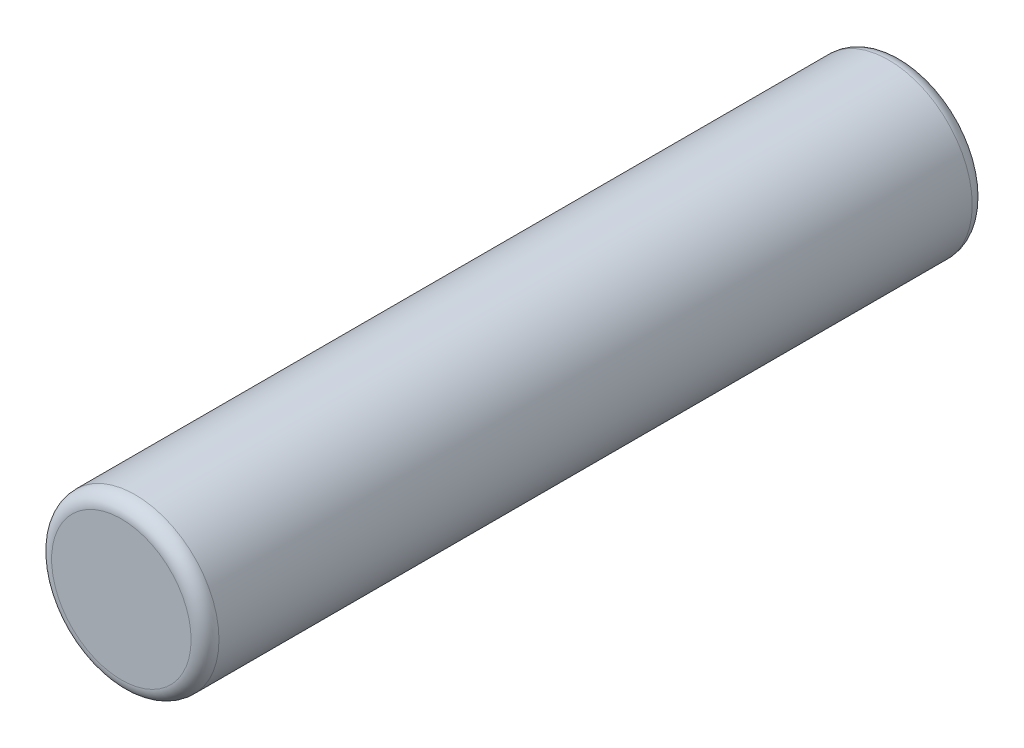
SolidWorks part; units mm, degrees
ref_plane "Спереди" through (0, 0, 0) normal (0, 0, 1) x (1, 0, 0)
ref_plane "Сверху" through (0, 0, 0) normal (0, 1, 0) x (1, 0, 0)
ref_plane "Справа" through (0, 0, 0) normal (1, 0, 0) x (0, 0, -1)
sketch "Эскиз1" plane through (0, 0, 0) normal (0, 0, 1) x (1, 0, 0)
  circle A0 centre (0, 0) radius 1.5
  dimension "D1" = 3
extrude "Бобышка-Вытянуть1" add sketch "Эскиз1" along normal mid plane 14
fillet "Скругление1" radius 0.25 2 edges at (1.5, 0, -7) (1.5, 0, 7)
